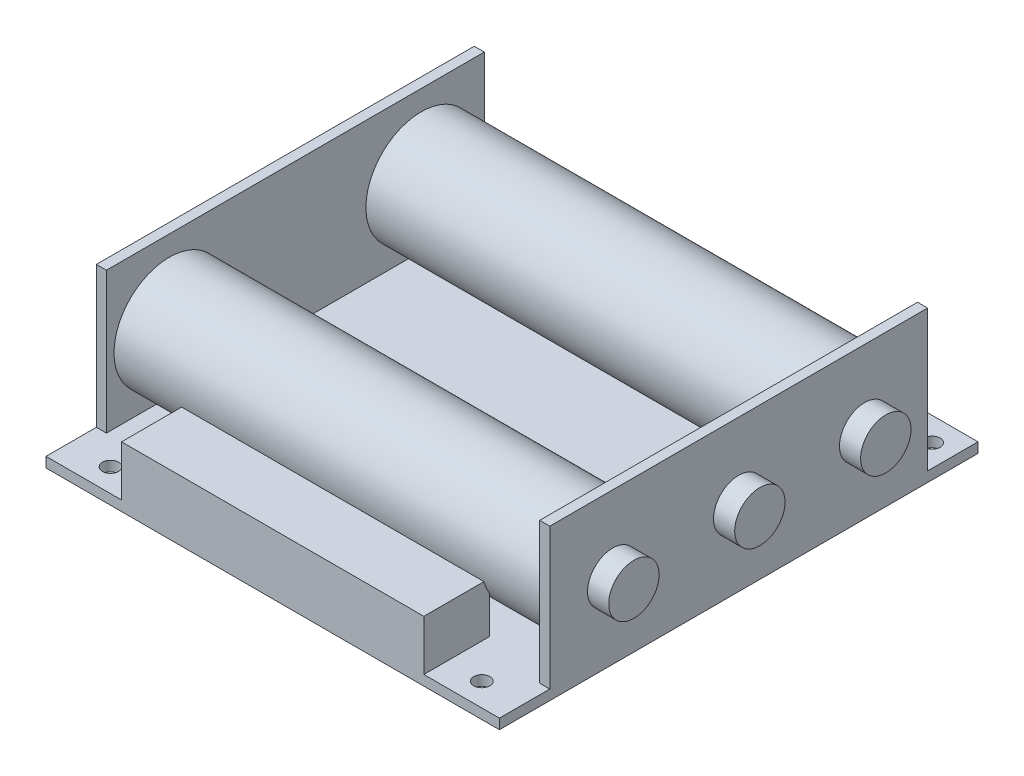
SolidWorks part; units mm, degrees
ref_plane "Front Plane" through (0, 0, 0) normal (0, 0, 1) x (1, 0, 0)
ref_plane "Top Plane" through (0, 0, 0) normal (0, 1, 0) x (1, 0, 0)
ref_plane "Right Plane" through (0, 0, 0) normal (1, 0, 0) x (0, 0, -1)
sketch "Sketch1" plane through (0, 0, 0) normal (0, 1, 0) x (1, 0, 0)
  line L1 (45, 47.5) -> (-45, 47.5)
  line L2 (45, 47.5) -> (45, -47.5)
  line L3 (45, -47.5) -> (-45, -47.5)
  line L4 (-45, 47.5) -> (-45, -47.5)
  line L5 (45, 47.5) -> (-45, -47.5) construction
  line L6 (45, -47.5) -> (-45, 47.5) construction
  point P0 (0, 0)
  dimension "D1" = 90
  dimension "D2" = 95
extrude "Boss-Extrude1" add sketch "Sketch1" along normal blind 2
hole_wizard "Ø3.2 (3.2) Diameter Hole1" positions "Sketch3" profile "Sketch2" hole size "Ø3.2" standard "ISO"
sketch "Sketch3" plane through (0, 0, 0) normal (0, -1, 0) x (-1, 0, 0)
  line L0 (45, 47.5) -> (45, -47.5) construction
  line L2 (45, -47.5) -> (-45, -47.5) construction
  line L3 (-45, -47.5) -> (-45, 47.5) construction
  line L4 (-45, 47.5) -> (45, 47.5) construction
  point P0 (36.8, -42.9)
  point P2 (-36.9, -42.9)
  point P4 (-40.6, 42.8)
  point P6 (39.4, 42.8)
  dimension "D1" = 8.2
  dimension "D2" = 4.6
  dimension "D3" = 8.1
  dimension "D4" = 4.6
  dimension "D5" = 4.7
  dimension "D6" = 4.4
  dimension "D7" = 4.7
  dimension "D8" = 5.6
sketch "Sketch2" plane through (-36.8, 0, 42.9) normal (1, 0, 0) x (0, 0, -1)
  line L0 (0, 0) -> (0, 2)
  line L1 (0, 2) -> (1.6, 2)
  line L2 (1.6, 2) -> (1.6, 0)
  line L5 (1.6, 0) -> (0, 0)
  line L11 (0, -6.35) -> (0, 107.95) construction
  dimension "Thru Hole Dia." = 3.2
  dimension "Thru Hole Depth" = 2
sketch "Sketch4" plane through (45, 0, 0) normal (1, 0, 0) x (0, 0, -1)
  line L0 (-47.5, 0) -> (47.5, 0) construction
  line L1 (-37.5, 0) -> (37.5, 0)
  line L2 (-37.5, 0) -> (-37.5, 30)
  line L3 (-37.5, 30) -> (37.5, 30)
  line L4 (37.5, 0) -> (37.5, 30)
  line L5 (-47.5, 2) -> (-47.5, 0) construction
  line L6 (47.5, 2) -> (47.5, 0) construction
  point P6 (-47.5, 1)
  dimension "D1" = 10
  dimension "D2" = 10
  dimension "D3" = 30
extrude "Boss-Extrude2" add sketch "Sketch4" against normal blind 2
mirror "Mirror1" about plane through (0, 0, 0) normal (1, 0, 0) of "Boss-Extrude2"
sketch "Sketch5" plane through (45, 0, 0) normal (1, 0, 0) x (0, 0, -1)
  line L0 (47.5, 2) -> (47.5, 0) construction
  line L2 (37.5, 30) -> (-37.5, 30) construction
  circle A0 centre (-25, 15) radius 5
  circle A1 centre (25, 15) radius 5
  point P4 (47.5, 1)
  dimension "D1" = 10
  dimension "D2" = 10
  dimension "D3" = 50
  dimension "D4" = 22.5
  dimension "D5" = 15
extrude "Boss-Extrude3" add sketch "Sketch5" along normal blind 4.2 and the other way blind 94.2
surface "Surface-Offset1" parameters "D1"=6
sketch "Sketch6" plane through (0, 2, 0) normal (0, 1, 0) x (1, 0, 0)
  line L0 (-45, -47.5) -> (45, -47.5) construction
  line L1 (-30, -34.5) -> (30, -34.5)
  line L2 (-30, -34.5) -> (-30, -47.5)
  line L3 (-30, -47.5) -> (30, -47.5)
  line L4 (30, -34.5) -> (30, -47.5)
  line L5 (-45, -37.5) -> (-45, -47.5) construction
  line L6 (45, -47.5) -> (45, -37.5) construction
  dimension "D1" = 15
  dimension "D2" = 15
  dimension "D3" = 13
extrude "Boss-Extrude4" add sketch "Sketch6" along normal blind 10
sketch "Sketch7" plane through (-45, 0, 0) normal (-1, 0, 0) x (0, 0, 1)
  line L0 (-37.5, 30) -> (37.5, 30) construction
  circle A0 centre (0, 15) radius 5
  dimension "D1" = 10
  dimension "D2" = 15
extrude "Boss-Extrude5" add sketch "Sketch7" along normal blind 4.2
mirror "Mirror2" about plane through (0, 0, 0) normal (1, 0, 0) of "Boss-Extrude5"
